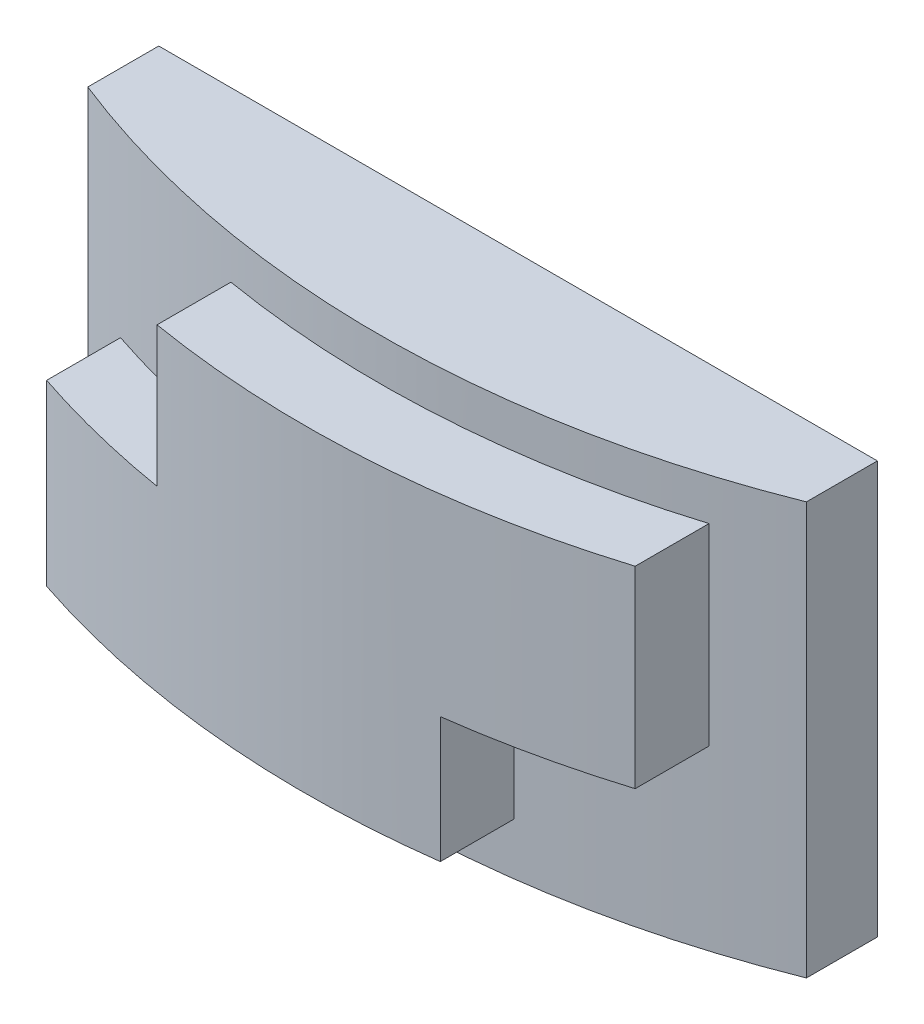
SolidWorks part; units mm, degrees
ref_plane "Front" through (0, 0, 0) normal (0, 0, 1) x (1, 0, 0)
ref_plane "Top" through (0, 0, 0) normal (0, 1, 0) x (1, 0, 0)
ref_plane "Right" through (0, 0, 0) normal (1, 0, 0) x (0, 0, -1)
sketch "Sketch2" plane through (0, 0, 0) normal (0, 1, 0) x (1, 0, 0)
  line L0 (-59.3912, 0) -> (-59.3912, 11.9529)
  line L1 (-59.3912, 11.9529) -> (61.6324, 11.9529)
  line L2 (61.6324, 11.9529) -> (61.6324, 0)
  arc A0 (-59.3912, 0) -> (61.6324, 0) centre (1.1206, 152.2675) ccw
extrude "Extrude2" add sketch "Sketch2" along normal blind 69.4428
ref_plane "Plane1" through (0, 0, -82.3326) normal (0, 0, 1) x (1, 0, 0)
sketch "Sketch3" plane through (0, 0, -82.3326) normal (0, 0, 1) x (1, 0, 0)
  line L1 (22.5924, 8.76) -> (22.5924, 29.9103)
  line L2 (22.5924, 29.9103) -> (49.511, 29.9103)
  line L3 (49.511, 29.9103) -> (49.511, 62.3569)
  line L4 (49.511, 62.3569) -> (-25.9572, 62.3569)
  line L5 (-25.9572, 62.3569) -> (-25.9572, 38.8031)
  line L6 (-25.9572, 38.8031) -> (-50.7127, 38.8031)
  line L7 (-50.7127, 38.8031) -> (-50.7127, 8.76)
  line L8 (-50.7127, 8.76) -> (22.5924, 8.76)
extrude "Extrude8" add sketch "Sketch3" along normal blind 12.4428 from surface
